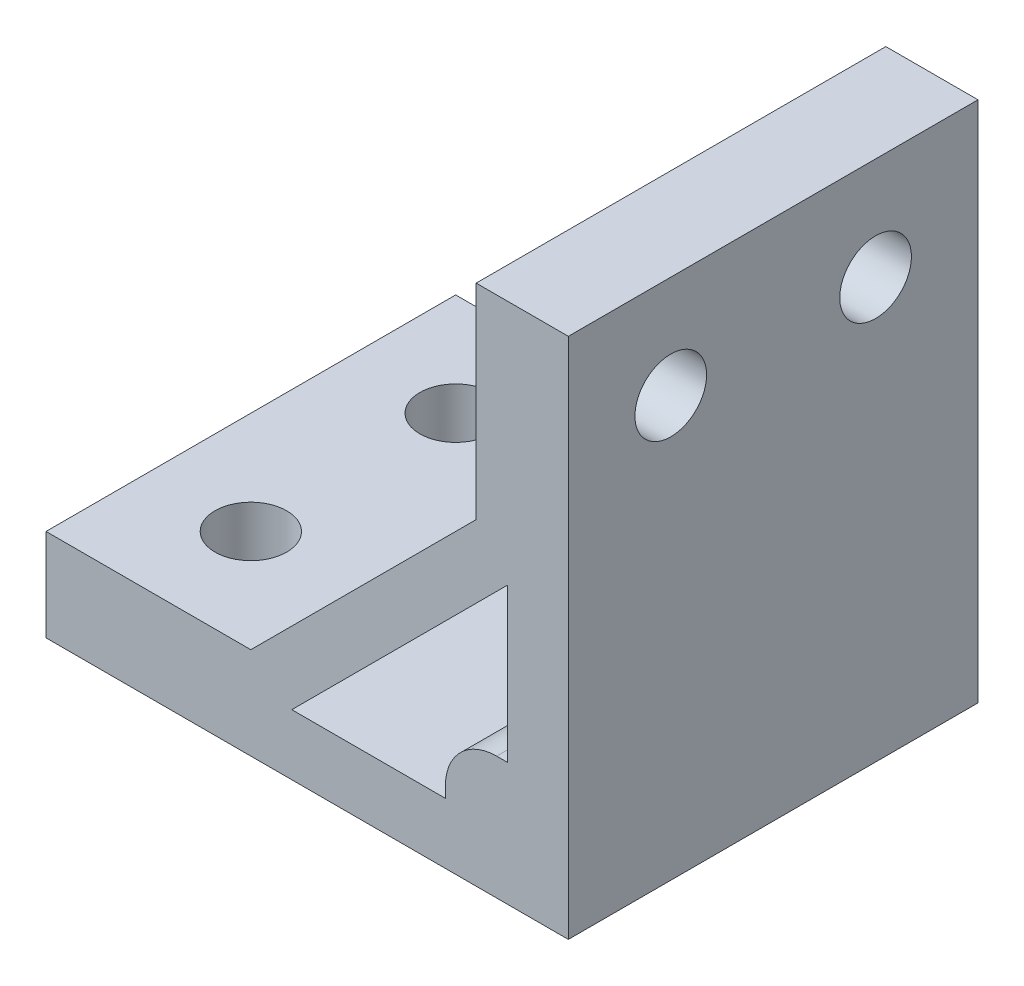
SolidWorks part; units mm, degrees
ref_plane "前视基准面" through (0, 0, 0) normal (0, 0, 1) x (1, 0, 0)
ref_plane "上视基准面" through (0, 0, 0) normal (0, 1, 0) x (1, 0, 0)
ref_plane "右视基准面" through (0, 0, 0) normal (1, 0, 0) x (0, 0, -1)
sketch "草图1" plane through (0, 0, 0) normal (0, 0, 1) x (1, 0, 0)
  line L0 (0, 0) -> (0, 51)
  line L1 (0, 51) -> (-9, 51)
  line L2 (-9, 51) -> (-9, 31)
  line L3 (-9, 31) -> (-31, 9)
  line L4 (-31, 9) -> (-51, 9)
  line L5 (-51, 9) -> (-51, 0)
  line L6 (-51, 0) -> (0, 0)
  line L7 (-5.9289, 27) -> (-27, 5.9289)
  line L8 (-27, 5.9289) -> (-12, 5.9289)
  line L9 (-12, 5.9289) -> (-12, 12)
  line L10 (-12, 12) -> (-5.9289, 12)
  line L11 (-5.9289, 12) -> (-5.9289, 27)
  dimension "D1" = 51
  dimension "D2" = 51
  dimension "D3" = 9
  dimension "D4" = 9
  dimension "D5" = 45
  dimension "D6" = 20
  dimension "D7" = 12
  dimension "D8" = 12
  dimension "D9" = 5
  dimension "D10" = 15
  dimension "D11" = 15
extrude "凸台-拉伸1" add sketch "草图1" along normal blind 40
fillet "圆角1" radius 5 1 edges at (-12, 12, 20)
sketch "草图3" plane through (0, 0, 0) normal (1, 0, 0) x (0, 0, -1)
  line L0 (-20, 0) -> (-20, 41) construction
  line L1 (-40, 0) -> (0, 0) construction
  line L2 (-20, 41) -> (-10, 41) construction
  line L3 (-20, 41) -> (-30, 41) construction
  circle A0 centre (-10, 41) radius 3.5
  circle A1 centre (-30, 41) radius 3.5
  dimension "D1" = 7
  dimension "D2" = 7
  dimension "D3" = 41
  dimension "D4" = 10
  dimension "D5" = 10
extrude "切除-拉伸1" cut sketch "草图3" against normal blind 40
sketch "草图4" plane through (0, 0, 0) normal (0, -1, 0) x (1, 0, 0)
  line L0 (0, 20) -> (-41, 20) construction
  line L1 (0, 40) -> (0, 0) construction
  line L2 (-41, 20) -> (-41, 30) construction
  line L3 (-41, 20) -> (-41, 10) construction
  circle A0 centre (-41, 10) radius 3.5
  circle A1 centre (-41, 30) radius 3.5
  dimension "D3" = 7
  dimension "D5" = 7
  dimension "D1" = 41
  dimension "D2" = 10
  dimension "D4" = 10
extrude "切除-拉伸2" cut sketch "草图4" against normal blind 40
